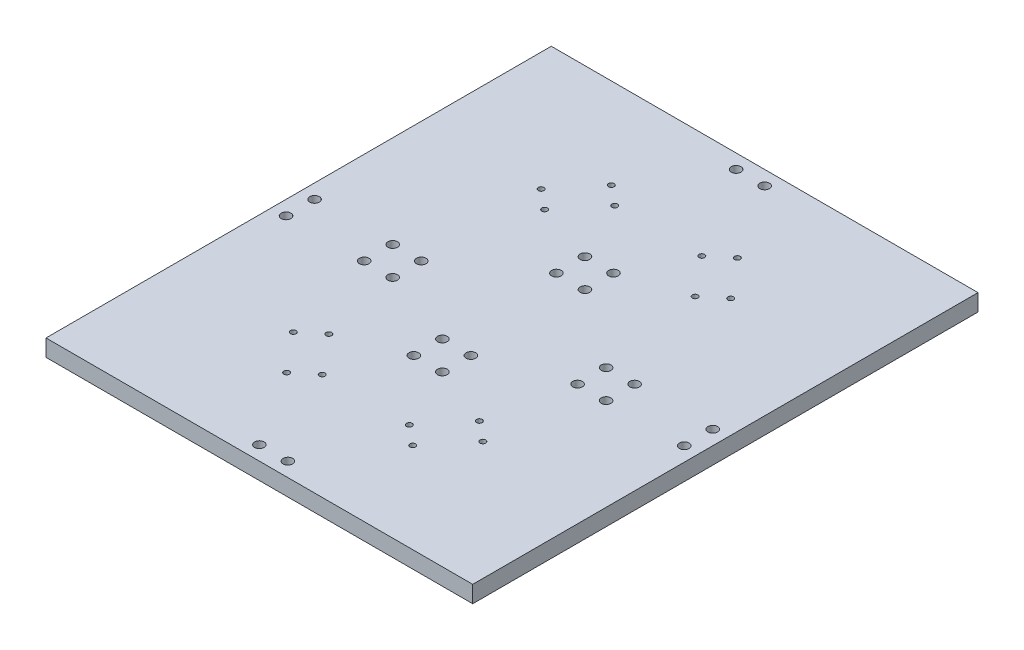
SolidWorks part; units mm, degrees
ref_plane "Front Plane" through (0, 0, 0) normal (0, 0, 1) x (1, 0, 0)
ref_plane "Top Plane" through (0, 0, 0) normal (0, 1, 0) x (1, 0, 0)
ref_plane "Right Plane" through (0, 0, 0) normal (1, 0, 0) x (0, 0, -1)
sketch "Thruster Placement Diagram" plane through (0, 0, 0) normal (0, 1, 0) x (1, 0, 0)
  line L7 (-112.019, -180) -> (112.019, -180)
  line L8 (-152.019, -140) -> (-152.019, 140)
  line L9 (-112.019, 180) -> (112.019, 180)
  line L10 (152.019, -140) -> (152.019, 140)
  line L11 (-152.019, -180) -> (152.019, 180) construction
  line L12 (-152.019, 180) -> (152.019, -180) construction
  line L17 (-90, -125) -> (90, -125) construction
  line L18 (-90, -125) -> (-90, 125) construction
  line L19 (-90, 125) -> (90, 125) construction
  line L20 (90, -125) -> (90, 125) construction
  line L21 (-90, -125) -> (90, 125) construction
  line L22 (-90, 125) -> (90, -125) construction
  line L23 (-165, -75) -> (165, -75) construction
  line L24 (-165, -75) -> (-165, 75) construction
  line L25 (-165, 75) -> (165, 75) construction
  line L26 (165, -75) -> (165, 75) construction
  line L27 (-165, -75) -> (165, 75) construction
  line L28 (-165, 75) -> (165, -75) construction
  line L34 (0, -125) -> (0, 125) construction
  line L35 (112.019, 180) -> (152.019, 180)
  line L36 (152.019, 180) -> (152.019, 140)
  line L38 (-112.019, 180) -> (-152.019, 180)
  line L39 (-152.019, 180) -> (-152.019, 140)
  line L41 (-152.019, -140) -> (-152.019, -180)
  line L42 (-152.019, -180) -> (-112.019, -180)
  line L43 (112.019, -180) -> (152.019, -180)
  line L44 (152.019, -180) -> (152.019, -140)
  circle A0 centre (-90, 125) radius 56 construction
  circle A1 centre (90, 125) radius 56 construction
  circle A2 centre (-90, -125) radius 56 construction
  circle A3 centre (90, -125) radius 56 construction
  point P0 (0, 0)
  point P32 (0, 0)
  point P39 (0, 0)
  dimension "D3" = 112
  dimension "D1" = 304.038
  dimension "D2" = 360
  dimension "D5" = 250
  dimension "D6" = 180
  dimension "D7" = 150
  dimension "D8" = 330
extrude "12mm thick" add sketch "Thruster Placement Diagram" along normal blind 12
sketch "Location Sketch" plane through (0, 12, 0) normal (0, 1, 0) x (1, 0, 0)
  line L13 (0, 0) -> (0, -196.1378) construction
  line L23 (-45, 120.2707) -> (-45, 87.5) construction
  line L24 (-45, 87.5) -> (-72.0616, 87.5) construction
  line L25 (-90, 0) -> (0, 0) construction
  line L26 (-90, -125) -> (-90, 125) construction
  line L33 (72.0616, 87.5) -> (45, 120.2707) construction
  line L34 (45, 87.5) -> (72.0616, 87.5) construction
  line L35 (45, 120.2707) -> (45, 87.5) construction
  line L37 (-45, -87.5) -> (45, -87.5) construction
  line L38 (-45, -87.5) -> (-45, 87.5) construction
  line L39 (-45, 87.5) -> (45, 87.5) construction
  line L40 (45, -87.5) -> (45, 87.5) construction
  line L41 (-45, -87.5) -> (45, 87.5) construction
  line L42 (-45, 87.5) -> (45, -87.5) construction
  line L58 (53.5558, 72.2181) -> (72.0616, 87.5)
  line L60 (45, 120.2707) -> (26.4942, 104.9889)
  line L61 (72.0616, 87.5) -> (45, 120.2707)
  line L73 (53.5558, 72.2181) -> (26.4942, 104.9889)
  line L81 (-72.0616, 87.5) -> (-45, 120.2707)
  line L82 (-53.5558, 72.2181) -> (-72.0616, 87.5)
  line L83 (-53.5558, 72.2181) -> (-26.4942, 104.9889)
  line L84 (-45, 120.2707) -> (-26.4942, 104.9889)
  line L85 (-72.0616, 87.5) -> (-45, 120.2707) construction
  line L86 (72.0616, -87.5) -> (45, -120.2707)
  line L87 (53.5558, -72.2181) -> (72.0616, -87.5)
  line L88 (53.5558, -72.2181) -> (26.4942, -104.9889)
  line L89 (45, -120.2707) -> (26.4942, -104.9889)
  line L90 (-53.5558, -72.2181) -> (-72.0616, -87.5)
  line L91 (-53.5558, -72.2181) -> (-26.4942, -104.9889)
  line L92 (-45, -120.2707) -> (-26.4942, -104.9889)
  line L93 (-72.0616, -87.5) -> (-45, -120.2707)
  circle A16 centre (53.6404, 76.8271) radius 2
  circle A17 centre (67.5198, 88.2885) radius 2
  circle A18 centre (44.9154, 115.6617) radius 2
  circle A19 centre (31.036, 104.2003) radius 2
  circle A32 centre (-67.5198, 88.2885) radius 2
  circle A33 centre (-53.6404, 76.8271) radius 2
  circle A34 centre (-44.9154, 115.6617) radius 2
  circle A35 centre (-31.036, 104.2003) radius 2
  circle A36 centre (67.5198, -88.2885) radius 2
  circle A37 centre (53.6404, -76.8271) radius 2
  circle A38 centre (44.9154, -115.6617) radius 2
  circle A39 centre (31.036, -104.2003) radius 2
  circle A40 centre (-31.036, -104.2003) radius 2
  circle A41 centre (-44.9154, -115.6617) radius 2
  circle A42 centre (-53.6404, -76.8271) radius 2
  circle A43 centre (-67.5198, -88.2885) radius 2
  dimension "D2" = 3
  dimension "D9" = 3.5
  dimension "D10" = 3.5
  dimension "D11" = 3.5
  dimension "D12" = 3.5
  dimension "D3" = 3
  dimension "D4" = 3
  dimension "D7" = 3
  dimension "D13" = 18
  dimension "D1" = 90
  dimension "D5" = 24
  dimension "D6" = 42.5
  dimension "D8" = 175
extrude "Cut-Extrude1" cut sketch "Location Sketch" against normal up to next
sketch "Sketch1" plane through (0, 12, 0) normal (0, 1, 0) x (1, 0, 0)
  line L0 (-152.019, -8.976) -> (152.019, -8.976) construction
  line L1 (-152.019, 180) -> (-152.019, -180) construction
  line L2 (152.019, -180) -> (152.019, 180) construction
  line L3 (0, -8.976) -> (0, 29.8564) construction
  line L4 (152.019, 180) -> (-152.019, 180) construction
  line L5 (0, -8.976) -> (-152.019, -8.976) construction
  line L6 (-152.019, -8.976) -> (-76.0095, -8.976) construction
  line L7 (-76.0095, -8.976) -> (-76.0095, 1.184) construction
  line L8 (-76.0095, 1.184) -> (-65.8495, 1.184) construction
  line L9 (-65.8495, 1.184) -> (-65.8495, -19.136) construction
  line L10 (-65.8495, -19.136) -> (-86.1695, -19.136) construction
  line L11 (-86.1695, -19.136) -> (-86.1695, 1.184) construction
  line L12 (-86.1695, 1.184) -> (-76.0095, 1.184) construction
  line L13 (-86.1695, -8.976) -> (-65.8495, -8.976) construction
  circle A0 centre (-86.1695, 1.184) radius 3.429
  circle A1 centre (-65.8495, 1.184) radius 3.429
  circle A2 centre (-86.1695, -19.136) radius 3.429
  circle A3 centre (-65.8495, -19.136) radius 3.429
  circle A4 centre (65.8495, 1.184) radius 3.429
  circle A5 centre (65.8495, -19.136) radius 3.429
  circle A6 centre (86.1695, -19.136) radius 3.429
  circle A7 centre (86.1695, 1.184) radius 3.429
  dimension "D2" = 6.858
  dimension "D1" = 188.976
  dimension "D3" = 20.32
extrude "Cut-Extrude2" cut sketch "Sketch1" against normal up to next
sketch "Sketch2" plane through (0, 12, 0) normal (0, 1, 0) x (1, 0, 0)
  line L0 (-86.1695, 1.184) -> (-65.8495, 1.184) construction
  line L1 (-152.019, 1.184) -> (-141.859, 1.184) construction
  line L2 (-152.019, 180) -> (-152.019, -180) construction
  line L3 (-141.859, 1.184) -> (-141.859, -19.136) construction
  line L4 (-141.859, -19.136) -> (-152.019, -19.136) construction
  line L5 (-86.1695, -19.136) -> (-65.8495, -19.136) construction
  line L6 (0, 0) -> (0, 21.1277) construction
  circle A0 centre (-141.859, 1.184) radius 3.429
  circle A1 centre (-141.859, -19.136) radius 3.429
  circle A2 centre (-86.1695, 1.184) radius 3.429 construction
  circle A3 centre (141.859, -19.136) radius 3.429
  circle A4 centre (141.859, 1.184) radius 3.429
  dimension "D1" = 10.16
extrude "Cut-Extrude3" cut sketch "Sketch2" against normal up to next
sketch "Sketch4" plane through (0, 12, 0) normal (0, 1, 0) x (1, 0, 0)
  line L0 (0, -180) -> (0, 180) construction
  line L1 (152.019, 180) -> (-152.019, 180) construction
  line L2 (-152.019, -180) -> (152.019, -180) construction
  line L3 (-10.16, 180) -> (-10.16, 169.84) construction
  line L4 (-10.16, 169.84) -> (0, 169.84) construction
  line L5 (0, 169.84) -> (10.16, 169.84) construction
  line L6 (10.16, 169.84) -> (10.16, 180) construction
  line L7 (0, 0) -> (27.0954, 0) construction
  circle A0 centre (-10.16, 169.84) radius 3.429
  circle A1 centre (10.16, 169.84) radius 3.429
  circle A2 centre (10.16, -169.84) radius 3.429
  circle A3 centre (-10.16, -169.84) radius 3.429
  dimension "D1" = 6.858
  dimension "D2" = 10.16
extrude "Cut-Extrude4" cut sketch "Sketch4" against normal up to next
sketch "Sketch5" plane through (0, 12, 0) normal (0, 1, 0) x (1, 0, 0)
  line L0 (0, 180) -> (0, -180) construction
  line L1 (152.019, 180) -> (-152.019, 180) construction
  line L2 (-152.019, -180) -> (152.019, -180) construction
  line L3 (-65.8495, 1.184) -> (65.8495, 1.184) construction
  line L4 (-65.8495, 41.824) -> (65.8495, 41.824) construction
  line L5 (-65.8495, 62.144) -> (65.8495, 62.144) construction
  line L6 (-10.16, 169.84) -> (-10.16, 62.144) construction
  line L7 (-10.16, 62.144) -> (-10.16, 41.824) construction
  line L8 (10.16, 169.84) -> (10.16, 62.144) construction
  line L9 (10.16, 62.144) -> (10.16, 41.824) construction
  circle A0 centre (-10.16, 62.144) radius 3.429
  circle A1 centre (10.16, 62.144) radius 3.429
  circle A2 centre (10.16, 41.824) radius 3.429
  circle A3 centre (-10.16, 41.824) radius 3.429
  circle A4 centre (10.16, -39.456) radius 3.429
  circle A5 centre (-10.16, -39.456) radius 3.429
  circle A6 centre (10.16, -59.776) radius 3.429
  circle A7 centre (-10.16, -59.776) radius 3.429
  dimension "D3" = 6.858
  dimension "D1" = 40.64
  dimension "D2" = 20.32
extrude "Cut-Extrude5" cut sketch "Sketch5" against normal up to next
